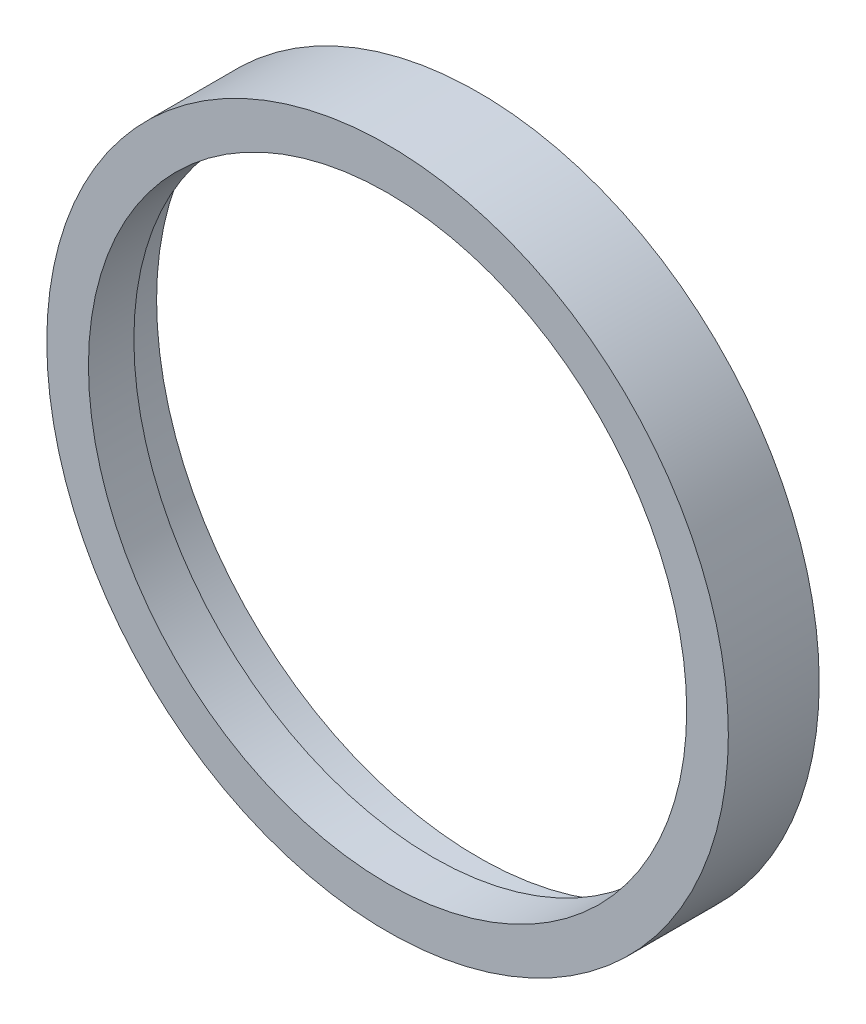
SolidWorks part; units mm, degrees
ref_plane "Front Plane" through (0, 0, 0) normal (0, 0, 1) x (1, 0, 0)
ref_plane "Top Plane" through (0, 0, 0) normal (0, 1, 0) x (1, 0, 0)
ref_plane "Right Plane" through (0, 0, 0) normal (1, 0, 0) x (0, 0, -1)
sketch "Sketch1" plane through (0, 0, 0) normal (0, 0, 1) x (1, 0, 0)
  circle A0 centre (0, 0) radius 28.575
  circle A1 centre (0, 0) radius 25.0825
  dimension "D1" = 50.165
  dimension "D2" = 57.15
extrude "Boss-Extrude1" add sketch "Sketch1" along normal blind 7.62
sketch "Sketch2" plane through (0, 0, 0) normal (0, 0, 1) x (1, 0, 0)
  circle A0 centre (0, 0) radius 26.9875
  dimension "D1" = 53.975
extrude "Cut-Extrude1" cut sketch "Sketch2" along normal blind 3.81
